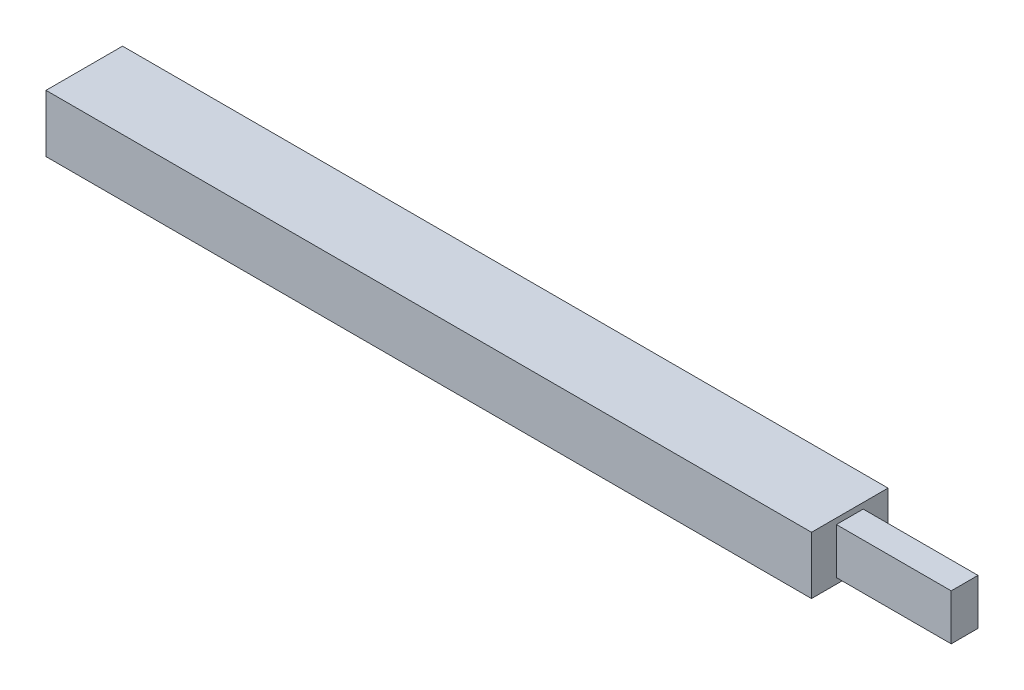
SolidWorks part; units mm, degrees
ref_plane "Front Plane" through (0, 0, 0) normal (0, 0, 1) x (1, 0, 0)
ref_plane "Top Plane" through (0, 0, 0) normal (0, 1, 0) x (1, 0, 0)
ref_plane "Right Plane" through (0, 0, 0) normal (1, 0, 0) x (0, 0, -1)
sketch "Sketch1" plane through (0, 0, 0) normal (0, 1, 0) x (1, 0, 0)
  line L0 (-100, 10) -> (100, 10)
  line L1 (100, 10) -> (100, -10)
  line L2 (100, -10) -> (-100, -10)
  line L3 (-100, -10) -> (-100, 10)
  point P7 (5.2209, -2.8916)
  dimension "D1" = 200
  dimension "D2" = 20
  dimension "D3" = 100
  dimension "D4" = 10
extrude "Boss-Extrude1" add sketch "Sketch1" along normal blind 15
sketch "Sketch2" plane through (100, 0, 0) normal (1, 0, 0) x (0, 0, -1)
  line L0 (-3.5, 13.5) -> (-3.5, 1.5)
  line L1 (-3.5, 1.5) -> (3.5, 1.5)
  line L2 (3.5, 1.5) -> (3.5, 13.5)
  line L3 (3.5, 13.5) -> (-3.5, 13.5)
  line L4 (-10, 0) -> (10, 0) construction
  line L5 (-10, 15) -> (10, 15) construction
  dimension "D1" = 1.5
  dimension "D2" = 1.5
  dimension "D3" = 7
  dimension "D4" = 3.5
extrude "Boss-Extrude2" add sketch "Sketch2" along normal blind 30
